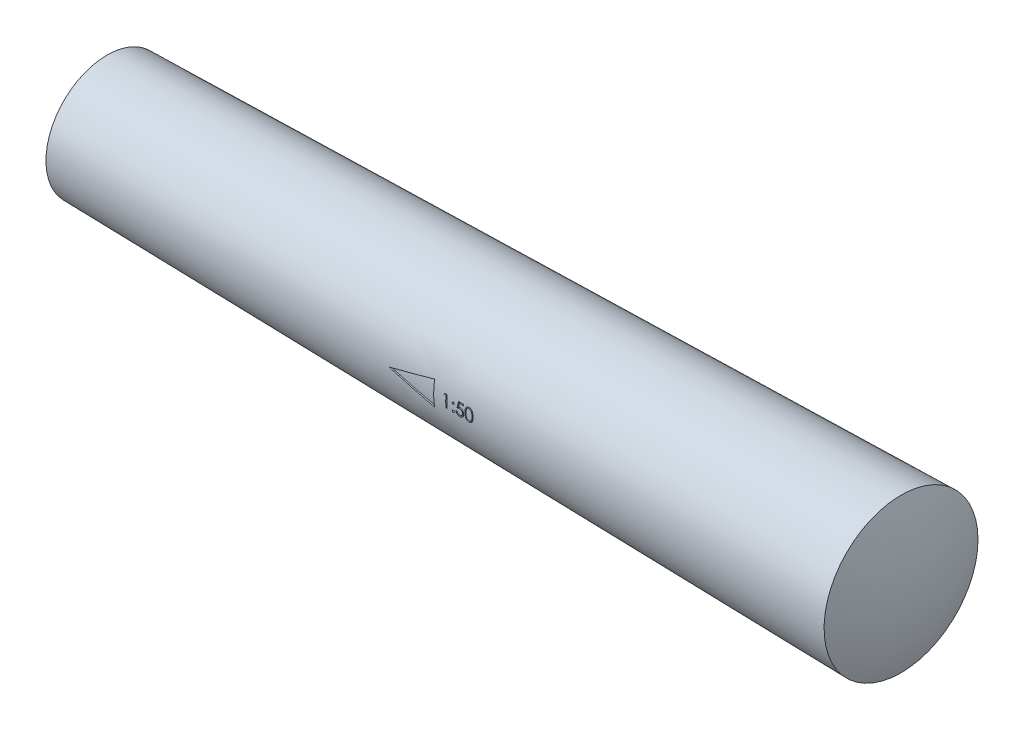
SolidWorks part; units mm, degrees
ref_plane "Front Plane" through (0, 0, 0) normal (0, 0, 1) x (1, 0, 0)
ref_plane "Top Plane" through (0, 0, 0) normal (0, 1, 0) x (1, 0, 0)
ref_plane "Right Plane" through (0, 0, 0) normal (1, 0, 0) x (0, 0, -1)
sketch "Sketch1" plane through (0, 0, 0) normal (1, 0, 0) x (0, 0, -1)
  circle A0 centre (0, 0) radius 5
  dimension "D1" = 10
extrude "Extrude1" add sketch "Sketch1" along normal mid plane 65
draft "Draft1" type of draft neutral plane draft angle 1.146 faces to draft 1 parameters "D1"=1.146
sketch "Sketch2" plane through (0, 0, 0) normal (0, 0, 1) x (1, 0, 0)
  line L0 (-32.5, 0) -> (-32.5, 5)
  line L1 (-32.5, 5) -> (-32.5, -5) construction
  line L2 (-32.5, 0) -> (-33.7, 0)
  line L3 (-33.7, 0) -> (-33.7, -5.65) construction
  line L4 (32.5, 0) -> (32.5, 6.3)
  line L5 (32.5, -6.3) -> (32.5, 6.3) construction
  line L6 (32.5, 0) -> (33.7, 0)
  line L7 (33.7, 0) -> (33.7, -5.65) construction
  line L8 (-32.5, -5) -> (32.5, -6.3) construction
  arc A0 (-33.7, 0) -> (-32.5, 5) centre (-22.6833, 0) cw
  arc A1 (33.7, 0) -> (32.5, 6.3) centre (16.5623, 0) ccw
  point P14 (0, -5.65)
revolve "Revolve1" add sketch "Sketch2" angle 360 about L2
sketch "Sketch5" plane through (0, 0, 0) normal (0, 0, 1) x (1, 0, 0)
  line L0 (0, 5.65) -> (0, -5.65) construction
  line L1 (32.5, 6.3) -> (-32.5, 5) construction
  line L2 (-32.5, -5) -> (32.5, -6.3) construction
ref_plane "Plane2" through (0, 0, 0) normal (-0.02, 0, 0.9998) x (0.9998, 0, 0.02)
sketch "Sketch6" plane through (0, 0, 0) normal (-0.02, 0, 0.9998) x (0.9998, 0, 0.02)
  line L0 (0, 0) -> (0, 1)
  line L1 (0, 5.65) -> (0, -5.65) construction
  line L2 (0, 1) -> (-3.7321, 0)
  line L3 (-3.7321, 0) -> (0, -1)
  line L4 (0, -1) -> (0, 0)
  line L5 (0, -0.5) -> (4, -0.5) construction
  text T0 "1:50" font "Century Gothic" height 1
  dimension "D1" = 2
  dimension "D2" = 30
  dimension "D3" = 4
wrap "Wrap2" sketch "Sketch6" wrap type deboss source sketch "Sketch6" thickness 0.1 parameters "D1"=0.1
equation "\"D2@Sketch2\" = \"D1@Sketch2\""
